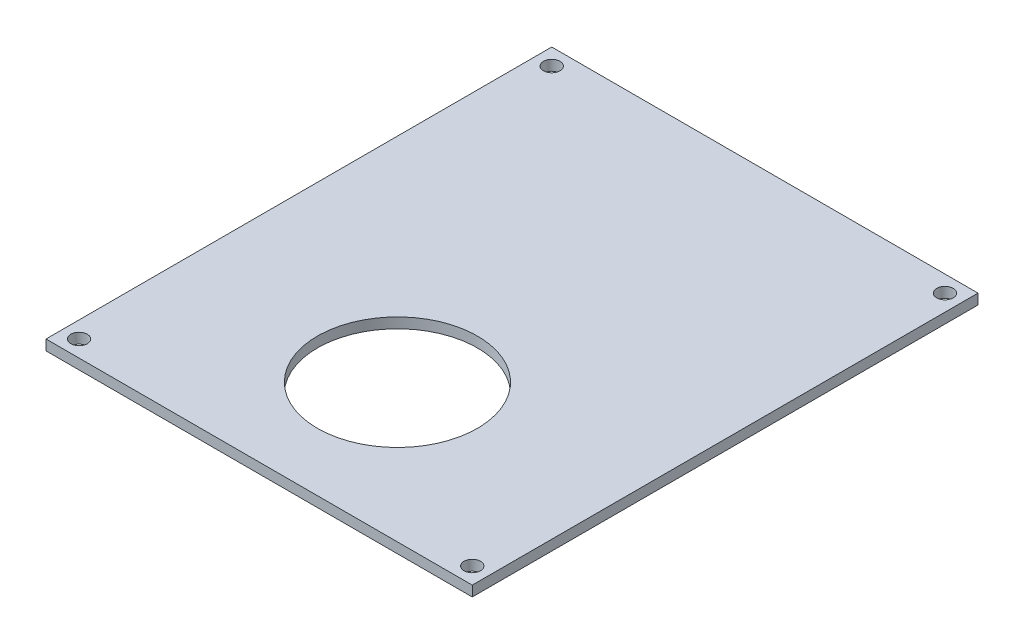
SolidWorks part; units mm, degrees
ref_plane "Front Plane" through (0, 0, 0) normal (0, 0, 1) x (1, 0, 0)
ref_plane "Top Plane" through (0, 0, 0) normal (0, 1, 0) x (1, 0, 0)
ref_plane "Right Plane" through (0, 0, 0) normal (1, 0, 0) x (0, 0, -1)
sketch "Sketch1" plane through (0, 0, 0) normal (0, 1, 0) x (1, 0, 0)
  line L1 (41.3, 49) -> (-41.3, 49)
  line L2 (41.3, 49) -> (41.3, -49)
  line L3 (41.3, -49) -> (-41.3, -49)
  line L4 (-41.3, 49) -> (-41.3, -49)
  line L5 (41.3, 49) -> (-41.3, -49) construction
  line L6 (41.3, -49) -> (-41.3, 49) construction
  point P0 (0, 0)
  dimension "D1" = 82.6
  dimension "D2" = 98
extrude "Boss-Extrude1" add sketch "Sketch1" along normal blind 2
hole_wizard "Ø3.2 (3.2) Diameter Hole1" positions "Sketch3" profile "Sketch2" hole size "Ø3.2" standard "ISO"
sketch "Sketch3" plane through (0, 2, 0) normal (0, 1, 0) x (1, 0, 0)
  line L0 (-41.3, 49) -> (-41.3, -49) construction
  line L1 (41.3, 49) -> (-41.3, 49) construction
  line L2 (41.3, -49) -> (41.3, 49) construction
  line L3 (-41.3, -49) -> (41.3, -49) construction
  point P0 (-38.1, 45.8)
  point P2 (38.1, 45.8)
  point P4 (38.1, -45.8)
  point P6 (-38.1, -45.8)
  dimension "D1" = 3.2
  dimension "D2" = 3.2
  dimension "D3" = 3.2
  dimension "D4" = 3.2
  dimension "D5" = 3.2
  dimension "D6" = 3.2
  dimension "D7" = 3.2
  dimension "D8" = 3.2
sketch "Sketch2" plane through (-38.1, 2, -45.8) normal (1, 0, 0) x (0, 0, 1)
  line L0 (0, 0) -> (0, 2)
  line L1 (0, 2) -> (1.6, 2)
  line L2 (1.6, 2) -> (1.6, 0)
  line L5 (1.6, 0) -> (0, 0)
  line L11 (0, -6.35) -> (0, 107.95) construction
  dimension "Thru Hole Dia." = 3.2
  dimension "Thru Hole Depth" = 2
sketch "Sketch4" plane through (0, 2, 0) normal (0, 1, 0) x (1, 0, 0)
  line L0 (-41.3, -49) -> (41.3, -49) construction
  circle A1 centre (0, -22.2) radius 15.5
  dimension "D2" = 31
  dimension "D3" = 26.8
extrude "Cut-Extrude1" cut sketch "Sketch4" against normal blind 2
